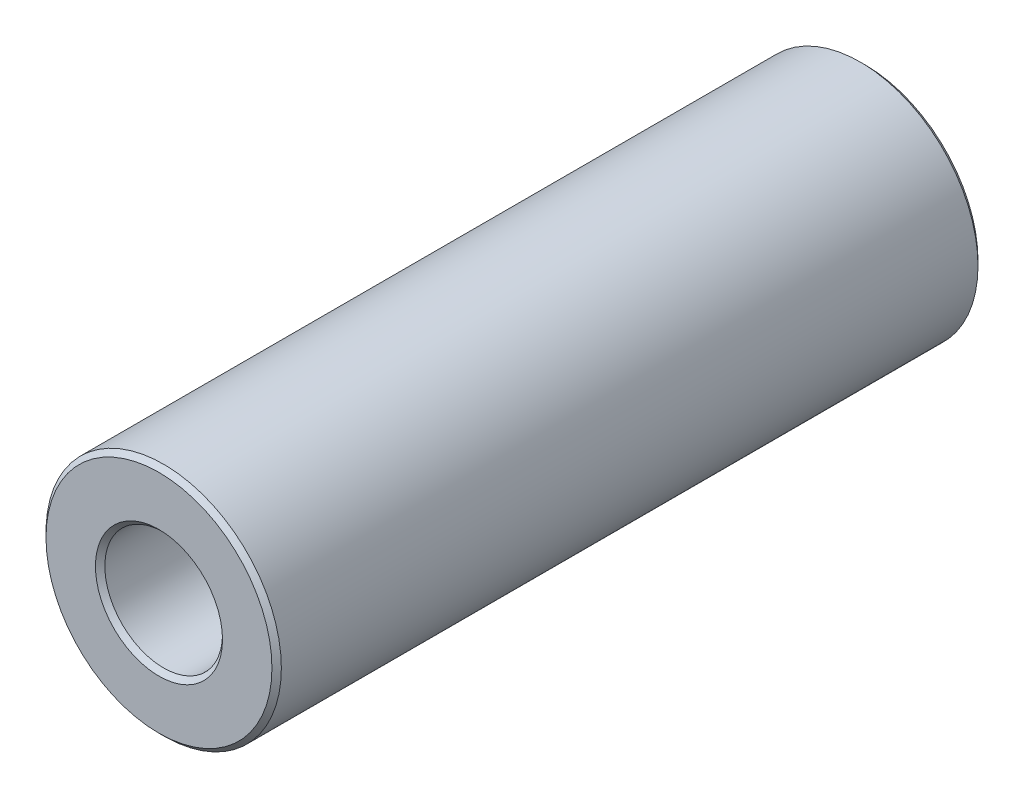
SolidWorks part; units mm, degrees
ref_plane "Front Plane" through (0, 0, 0) normal (0, 0, 1) x (1, 0, 0)
ref_plane "Top Plane" through (0, 0, 0) normal (0, 1, 0) x (1, 0, 0)
ref_plane "Right Plane" through (0, 0, 0) normal (1, 0, 0) x (0, 0, -1)
sketch "Sketch1" plane through (0, 0, 0) normal (0, 0, 1) x (1, 0, 0)
  circle A0 centre (0, 0) radius 2.5
  circle A1 centre (0, 0) radius 1.25
  dimension "D1" = 5
  dimension "D2" = 2.5
extrude "Boss-Extrude2" add sketch "Sketch1" along normal mid plane 15
chamfer "Chamfer3" distance 0.1 angle 45 4 edges at (2.5, 0, 7.5) (2.5, 0, -7.5) (1.25, 0, -7.5) (1.25, 0, 7.5)
